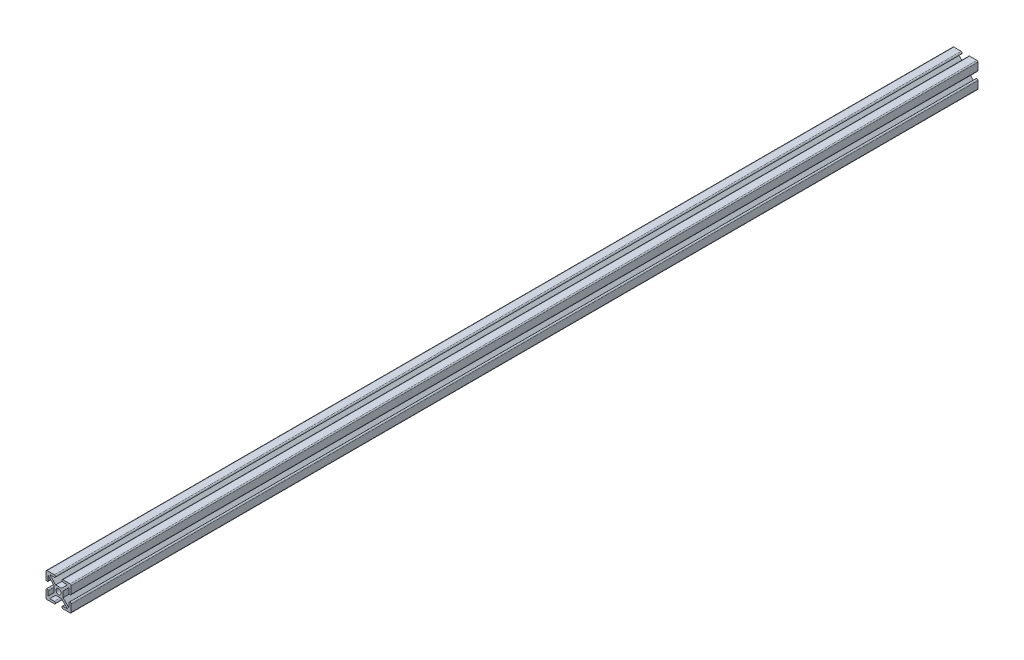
SolidWorks part; units mm, degrees
ref_plane "Front Plane" through (0, 0, 0) normal (0, 0, 1) x (1, 0, 0)
ref_plane "Top Plane" through (0, 0, 0) normal (0, 1, 0) x (1, 0, 0)
ref_plane "Right Plane" through (0, 0, 0) normal (1, 0, 0) x (0, 0, -1)
sketch "Sketch1" plane through (0, 0, 0) normal (0, 0, 1) x (1, 0, 0)
  line L0 (-2.9459, 4.5085) -> (-8.9276, 10.4902)
  line L1 (12.7, -12.7) -> (-12.7, -12.7) construction
  line L2 (12.7, -12.7) -> (12.7, 12.7) construction
  line L3 (12.7, 12.7) -> (-3.2385, 12.7) construction
  line L4 (-12.7, -12.7) -> (-12.7, 3.2385) construction
  line L5 (12.7, -12.7) -> (-12.7, 12.7) construction
  line L6 (12.7, 12.7) -> (-12.7, -12.7) construction
  line L7 (4.5085, -4.5085) -> (-4.5085, -4.5085)
  line L8 (4.5085, -4.5085) -> (4.5085, 4.5085)
  line L9 (4.5085, 4.5085) -> (-4.5085, 4.5085)
  line L10 (-4.5085, -4.5085) -> (-4.5085, 4.5085)
  line L11 (4.5085, -4.5085) -> (-4.5085, 4.5085) construction
  line L12 (4.5085, 4.5085) -> (-4.5085, -4.5085) construction
  line L13 (-8.9276, 10.4902) -> (-4.3434, 10.4902)
  line L14 (-3.2385, 10.4902) -> (-3.2385, 12.7) construction
  line L15 (-4.3434, 12.7) -> (-11.5951, 12.7)
  line L16 (-12.7, 11.5951) -> (-12.7, 4.3434)
  line L17 (-12.7, 3.2385) -> (-10.4902, 3.2385) construction
  line L18 (-10.4902, 4.3434) -> (-10.4902, 8.9276)
  line L19 (-10.4902, 8.9276) -> (-4.5085, 2.9459)
  line L20 (0, -1000) -> (0, 49000) construction
  line L21 (-4.3434, 12.7) -> (-12.7, 12.7) construction
  line L22 (-10.4902, 8.9276) -> (-8.9276, 10.4902)
  line L23 (-12.7, 4.3434) -> (-12.7, 12.7) construction
  line L24 (4.5085, 2.9459) -> (10.4902, 8.9276)
  line L25 (10.4902, 8.9276) -> (10.4902, 4.3434)
  line L26 (12.7, 4.3434) -> (12.7, 11.5951)
  line L27 (11.5951, 12.7) -> (4.3434, 12.7)
  line L28 (4.3434, 10.4902) -> (8.9276, 10.4902)
  line L29 (8.9276, 10.4902) -> (2.9459, 4.5085)
  line L30 (8.9276, 10.4902) -> (10.4902, 8.9276)
  line L31 (10.4902, 3.2385) -> (12.7, 3.2385) construction
  line L32 (3.2385, 12.7) -> (3.2385, 10.4902) construction
  line L33 (12.7, 4.3434) -> (12.7, 12.7) construction
  line L34 (4.3434, 12.7) -> (12.7, 12.7) construction
  line L35 (2.9459, -4.5085) -> (8.9276, -10.4902)
  line L36 (8.9276, -10.4902) -> (4.3434, -10.4902)
  line L37 (4.3434, -12.7) -> (11.5951, -12.7)
  line L38 (12.7, -11.5951) -> (12.7, -4.3434)
  line L39 (10.4902, -4.3434) -> (10.4902, -8.9276)
  line L40 (10.4902, -8.9276) -> (4.5085, -2.9459)
  line L41 (10.4902, -8.9276) -> (8.9276, -10.4902)
  line L42 (3.2385, -10.4902) -> (3.2385, -12.7) construction
  line L43 (12.7, -3.2385) -> (10.4902, -3.2385) construction
  line L44 (4.3434, -12.7) -> (12.7, -12.7) construction
  line L45 (12.7, -4.3434) -> (12.7, -12.7) construction
  line L46 (-4.5085, -2.9459) -> (-10.4902, -8.9276)
  line L47 (-10.4902, -8.9276) -> (-10.4902, -4.3434)
  line L48 (-12.7, -4.3434) -> (-12.7, -11.5951)
  line L49 (-11.5951, -12.7) -> (-4.3434, -12.7)
  line L50 (-4.3434, -10.4902) -> (-8.9276, -10.4902)
  line L51 (-8.9276, -10.4902) -> (-2.9459, -4.5085)
  line L52 (-8.9276, -10.4902) -> (-10.4902, -8.9276)
  line L53 (-10.4902, -3.2385) -> (-12.7, -3.2385) construction
  line L54 (-3.2385, -12.7) -> (-3.2385, -10.4902) construction
  line L55 (-12.7, -4.3434) -> (-12.7, -12.7) construction
  line L56 (-4.3434, -12.7) -> (-12.7, -12.7) construction
  circle A0 centre (0, 0) radius 2.6035
  arc A1 (-4.3434, 12.7) -> (-4.3434, 10.4902) centre (-4.3434, 11.5951) cw
  arc A2 (-12.7, 4.3434) -> (-10.4902, 4.3434) centre (-11.5951, 4.3434) ccw
  arc A3 (-11.5951, 12.7) -> (-12.7, 11.5951) centre (-11.5951, 11.5951) ccw
  arc A4 (12.7, 4.3434) -> (10.4902, 4.3434) centre (11.5951, 4.3434) cw
  arc A5 (4.3434, 12.7) -> (4.3434, 10.4902) centre (4.3434, 11.5951) ccw
  arc A6 (12.7, 11.5951) -> (11.5951, 12.7) centre (11.5951, 11.5951) ccw
  arc A7 (4.3434, -12.7) -> (4.3434, -10.4902) centre (4.3434, -11.5951) cw
  arc A8 (12.7, -4.3434) -> (10.4902, -4.3434) centre (11.5951, -4.3434) ccw
  arc A9 (11.5951, -12.7) -> (12.7, -11.5951) centre (11.5951, -11.5951) ccw
  arc A10 (-12.7, -4.3434) -> (-10.4902, -4.3434) centre (-11.5951, -4.3434) cw
  arc A11 (-4.3434, -12.7) -> (-4.3434, -10.4902) centre (-4.3434, -11.5951) ccw
  arc A12 (-12.7, -11.5951) -> (-11.5951, -12.7) centre (-11.5951, -11.5951) ccw
  point P0 (0, 0)
  point P88 (0, 0)
  dimension "D3" = 5.207
  dimension "D7" = 1.1049
  dimension "D1" = 25.4
  dimension "D2" = 9.017
  dimension "D4" = 2.2098
  dimension "D5" = 2.2098
  dimension "D6" = 3.2385
  dimension "D9" = 6.477
  dimension "D8" = 4
extrude "Boss-Extrude1" add sketch "Sketch1" against normal mid plane 914.4 contours L15 A3 L16 A2 L18 L22 L13 A1 | L22 L19 L10 L9 L0 | L10 L7 L8 L9 A0 | L26 A6 L27 A5 L28 L30 L25 A4 | L30 L29 L9 L8 L24 | L41 L40 L8 L7 L35 | L37 A9 L38 A8 L39 L41 L36 A7 | L48 A12 L49 A11 L50 L52 L47 A10 | L52 L51 L7 L10 L46
